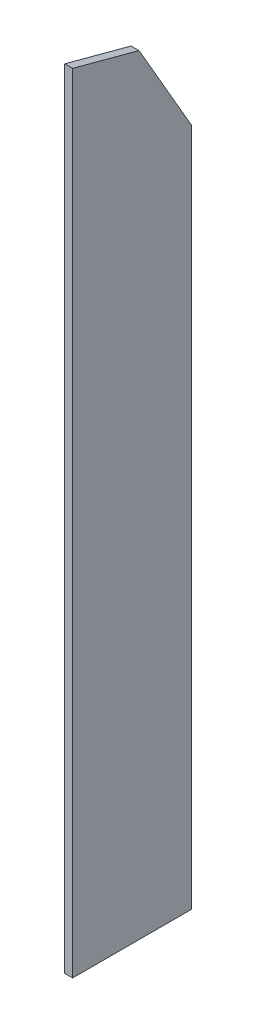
SolidWorks part; units mm, degrees
ref_plane "Front Plane" through (0, 0, 0) normal (1, 0, 0) x (0, 1, 0)
ref_plane "Top Plane" through (0, 0, 0) normal (0, 0, 1) x (0, 1, 0)
ref_plane "Right Plane" through (0, 0, 0) normal (0, 1, 0) x (-1, 0, 0)
sketch "Sketch1" plane through (0, 0, 0) normal (0, 1, 0) x (-1, 0, 0)
  line L1 (-25.4, 381) -> (25.4, 381)
  line L2 (-25.4, 381) -> (-25.4, -381)
  line L3 (-25.4, -381) -> (25.4, -381)
  line L4 (25.4, 381) -> (25.4, -381)
  line L5 (-25.4, 381) -> (25.4, -381) construction
  line L6 (-25.4, -381) -> (25.4, 381) construction
  point P0 (0, 0)
  dimension "D1" = 762
  dimension "D2" = 50.8
extrude "Boss-Extrude1" add sketch "Sketch1" along normal blind 5101.6125
ref_plane "Mating plane" through (0, 0, -631) normal (0, 0, -1) x (0, 1, 0)
chamfer "Chamfer1" distance 20 angle 45 4 edges at (0, 0, 381) (25.4, 0, 0) (0, 0, -381) (-25.4, 0, 0)
sketch "Sketch2" plane through (0, 0, 0) normal (1, 0, 0) x (0, 1, 0)
  line L2 (5101.6125, 381) -> (5101.6125, -381) construction
  line L7 (5101.6125, -381) -> (20, -381) construction
  line B0 (5101.6125, 485.605) -> (5101.6125, -381)
  line B1 (5101.6125, -381) -> (4380.4297, -381)
  line B2 (4380.4297, -379.701) -> (4380.4297, -381)
  line B3 (4959.3071, -45.4859) -> (5101.6125, 485.605)
  line B4 (4380.4297, -379.701) -> (4959.3071, -45.4859)
sketch_block_instance "Block1-1"
sketch_block "Block1"
extrude "Cut-Extrude1" cut sketch "Sketch2" against normal through all both and the other way through all
sketch "Sketch3" plane through (0, 0, 0) normal (1, 0, 0) x (0, 1, 0)
  line L1 (5101.6125, 381) -> (5101.6125, -381) construction
  line L2 (5101.6125, 381) -> (20, 381) construction
  line B0 (5101.6125, -485.605) -> (5101.6125, 381)
  line B1 (5101.6125, 381) -> (4380.4297, 381)
  line B2 (4380.4297, 379.701) -> (4380.4297, 381)
  line B3 (4959.3071, 45.4859) -> (5101.6125, -485.605)
  line B4 (4380.4297, 379.701) -> (4959.3071, 45.4859)
sketch_block_instance "Block1-3"
extrude "Cut-Extrude2" [suppressed] cut sketch "Sketch3" against normal through all both and the other way through all
